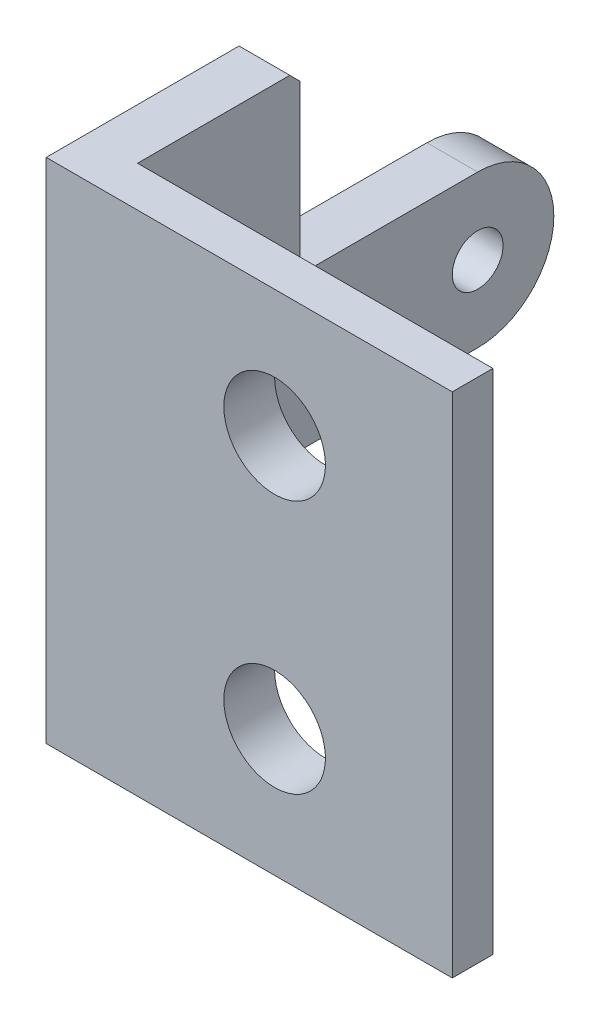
SolidWorks part; units mm, degrees
ref_plane "Front Plane" through (0, 0, 0) normal (0, 0, 1) x (1, 0, 0)
ref_plane "Top Plane" through (0, 0, 0) normal (0, 1, 0) x (1, 0, 0)
ref_plane "Right Plane" through (0, 0, 0) normal (1, 0, 0) x (0, 0, -1)
sketch "Sketch1" plane through (0, 0, 0) normal (0, 1, 0) x (1, 0, 0)
  line L0 (0, 40) -> (0, 0)
  line L1 (0, 0) -> (80, 0)
  line L2 (80, 0) -> (80, 10)
  line L3 (80, 10) -> (10, 10)
  line L4 (10, 10) -> (10, 40)
  line L5 (10, 40) -> (0, 40)
  dimension "D1" = 80
  dimension "D2" = 40
  dimension "D3" = 10
  dimension "D4" = 10
extrude "Boss-Extrude1" add sketch "Sketch1" along normal blind 100
sketch "Sketch2" plane through (0, 0, 0) normal (-1, 0, 0) x (0, 0, 1)
  line L0 (-40, 50) -> (-75, 50) construction
  line L1 (-40, 100) -> (-40, 0) construction
  line L2 (-40, 35) -> (-75, 35)
  line L3 (-40, 65) -> (-75, 65)
  line L4 (-40, 65) -> (-40, 35)
  circle A0 centre (-75, 50) radius 5
  arc A1 (-75, 65) -> (-75, 35) centre (-75, 50) ccw
  point P4 (-40, 50)
  dimension "D1" = 15
  dimension "D3" = 10
  dimension "D2" = 35
extrude "Boss-Extrude2" add sketch "Sketch2" against normal blind 10
sketch "Sketch3" plane through (0, 0, -10) normal (0, 0, -1) x (-1, 0, 0)
  circle A0 centre (-45, 75) radius 10
  circle A1 centre (-45, 25) radius 10
  dimension "D2" = 20
  dimension "D1" = 50
  dimension "D3" = 25
  dimension "D4" = 45
extrude "Cut-Extrude1" cut sketch "Sketch3" against normal blind 10
chamfer "Chamfer1" distance 2 angle 45 5 edges at (5, 0, -40) (5, 100, -40) (45, 100, -10) (45, 0, -10) (80, 50, -10)
